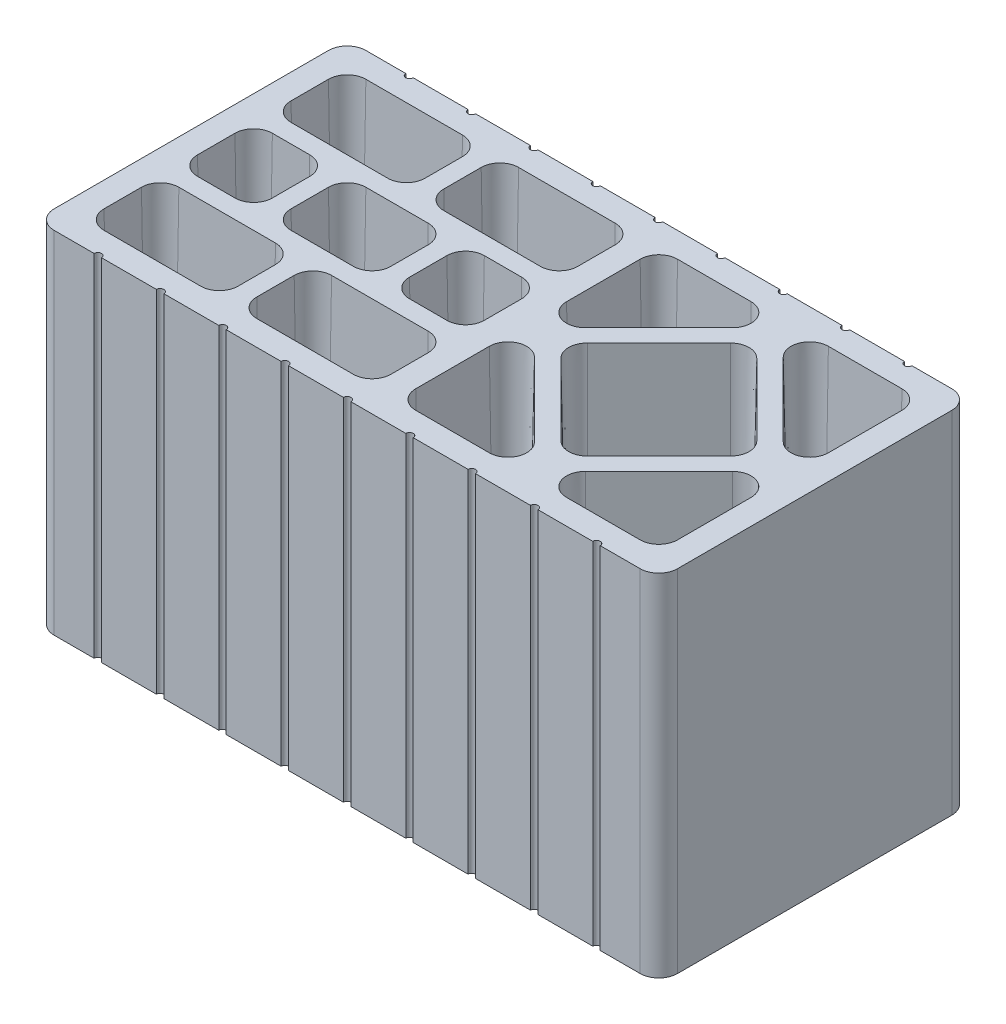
SolidWorks part; units mm, degrees
ref_plane "Plan de face" through (0, 0, 0) normal (0, 0, 1) x (1, 0, 0)
ref_plane "Plan de dessus" through (0, 0, 0) normal (0, 1, 0) x (1, 0, 0)
ref_plane "Plan de droite" through (0, 0, 0) normal (1, 0, 0) x (0, 0, -1)
sketch "Esquisse1" plane through (0, 0, 0) normal (0, 1, 0) x (1, 0, 0)
  line L0 (-4.5271, 0) -> (72.4679, 0) construction
  line L1 (1.5, 0) -> (4.7, 0)
  line L2 (0, 1.5) -> (0, 23.5)
  line L3 (1.5, 25) -> (4.7, 25)
  line L4 (50, 1.5) -> (50, 23.5)
  line L5 (0, -4.2553) -> (0, 43.6965) construction
  line L6 (25, -4.2553) -> (25, 43.6965) construction
  line L7 (-4.5271, 12.5) -> (72.4679, 12.5) construction
  line L8 (12.75, -2.4119) -> (12.75, 14.3543) construction
  line L9 (-4.5271, 2) -> (51.055, 2) construction
  line L10 (2, 28.4811) -> (2, -4.2553) construction
  line L11 (-3.7698, 9.5) -> (25.7079, 9.5) construction
  line L12 (-2.4036, 8.75) -> (-0.3375, 8.75) construction
  line L13 (8, 13.5253) -> (8, 5.2262) construction
  line L14 (3.5, 8) -> (11.25, 8)
  line L15 (2, 6.5) -> (2, 3.5)
  line L16 (13.5, -4.2553) -> (13.5, 14.3543) construction
  line L17 (14.25, -2.4119) -> (14.25, 14.3543) construction
  line L18 (-3.7698, 8) -> (25.7079, 8) construction
  line L19 (3.5, 2) -> (11.25, 2)
  line L20 (12.75, 6.5) -> (12.75, 3.5)
  line L21 (15.75, 8) -> (23.5, 8)
  line L22 (14.25, 6.5) -> (14.25, 3.5)
  line L23 (15.75, 2) -> (23.5, 2)
  line L24 (25, 6.5) -> (25, 3.5)
  line L25 (8.75, 13.5253) -> (8.75, 6.2202) construction
  line L26 (9.5, 13.5253) -> (9.5, 5.2262) construction
  line L27 (2, 14) -> (2, 11)
  line L28 (48, -3.2031) -> (48, 26.4901) construction
  line L29 (40.6005, 2) -> (46.5, 2)
  line L30 (37.5, 28.4811) -> (37.5, -0.4565) construction
  line L31 (37.0995, 2.1204) -> (51.8958, 16.9166) construction
  line L32 (39.5398, 20.4393) -> (45.4393, 14.5398)
  line L33 (36.7665, 3.9086) -> (50.1075, 17.2497) construction
  line L34 (3.5, 9.5) -> (6.5, 9.5)
  line L35 (8, 11) -> (8, 14)
  line L36 (9.5, 14) -> (9.5, 11)
  line L37 (11, 9.5) -> (16, 9.5)
  line L38 (17.5, 14) -> (17.5, 11)
  line L39 (19, 11) -> (19, 14)
  line L40 (23.5, 9.5) -> (20.5, 9.5)
  line L41 (25, 14) -> (25, 11)
  line L42 (48, 15.6005) -> (48, 21.5)
  line L43 (39.5398, 4.5607) -> (45.4393, 10.4602)
  line L44 (40.6005, 23) -> (46.5, 23)
  line L45 (35.4602, 4.5607) -> (29.5607, 10.4602)
  line L46 (23.5, 15.5) -> (20.5, 15.5)
  line L47 (11, 15.5) -> (16, 15.5)
  line L48 (3.5, 15.5) -> (6.5, 15.5)
  line L49 (48, 9.3995) -> (48, 3.5)
  line L50 (25, 18.5) -> (25, 21.5)
  line L51 (15.75, 23) -> (23.5, 23)
  line L52 (14.25, 18.5) -> (14.25, 21.5)
  line L53 (15.75, 17) -> (23.5, 17)
  line L54 (12.75, 18.5) -> (12.75, 21.5)
  line L55 (3.5, 23) -> (11.25, 23)
  line L56 (2, 18.5) -> (2, 21.5)
  line L57 (3.5, 17) -> (11.25, 17)
  line L58 (34.3995, 2) -> (28.5, 2)
  line L59 (27, 9.3995) -> (27, 3.5)
  line L60 (35.4602, 20.4393) -> (29.5607, 14.5398)
  line L61 (27, 15.6005) -> (27, 21.5)
  line L62 (34.3995, 23) -> (28.5, 23)
  line L63 (38.25, 1.0185) -> (38.25, 6.4411) construction
  line L66 (49.2106, 11.75) -> (44.014, 11.75) construction
  line L73 (5.3, 25) -> (9.7, 25)
  line L74 (10.3, 25) -> (14.7, 25)
  line L75 (15.3, 25) -> (19.7, 25)
  line L76 (38.5607, 5.7028) -> (44.2972, 11.4393)
  line L77 (20.3, 25) -> (24.7, 25)
  line L78 (45.3, 25) -> (48.5, 25)
  line L79 (40.3, 25) -> (44.7, 25)
  line L80 (35.3, 25) -> (39.7, 25)
  line L81 (30.3, 25) -> (34.7, 25)
  line L82 (25.3, 25) -> (29.7, 25)
  line L83 (25.3, 0) -> (29.7, 0)
  line L84 (30.3, 0) -> (34.7, 0)
  line L85 (35.3, 0) -> (39.7, 0)
  line L86 (40.3, 0) -> (44.7, 0)
  line L87 (45.3, 0) -> (48.5, 0)
  line L88 (5.3, 0) -> (9.7, 0)
  line L89 (10.3, 0) -> (14.7, 0)
  line L90 (15.3, 0) -> (19.7, 0)
  line L91 (20.3, 0) -> (24.7, 0)
  line L92 (36.4393, 5.7028) -> (30.7028, 11.4393)
  line L121 (36.4393, 19.2972) -> (30.7028, 13.5607)
  line L122 (38.5607, 19.2972) -> (44.2972, 13.5607)
  arc A0 (45.3, 25) -> (44.7, 25) centre (45, 25) cw
  arc A1 (5.3, 0) -> (4.7, 0) centre (5, 0) ccw
  arc A2 (10.3, 0) -> (9.7, 0) centre (10, 0) ccw
  arc A3 (15.3, 0) -> (14.7, 0) centre (15, 0) ccw
  arc A4 (20.3, 0) -> (19.7, 0) centre (20, 0) ccw
  arc A5 (25.3, 0) -> (24.7, 0) centre (25, 0) ccw
  arc A6 (30.3, 0) -> (29.7, 0) centre (30, 0) ccw
  arc A7 (35.3, 0) -> (34.7, 0) centre (35, 0) ccw
  arc A8 (40.3, 0) -> (39.7, 0) centre (40, 0) ccw
  arc A9 (45.3, 0) -> (44.7, 0) centre (45, 0) ccw
  circle A10 centre (0, 0) radius 0.3
  arc A11 (40.3, 25) -> (39.7, 25) centre (40, 25) cw
  arc A12 (35.3, 25) -> (34.7, 25) centre (35, 25) cw
  arc A13 (30.3, 25) -> (29.7, 25) centre (30, 25) cw
  arc A14 (25.3, 25) -> (24.7, 25) centre (25, 25) cw
  arc A15 (20.3, 25) -> (19.7, 25) centre (20, 25) cw
  arc A16 (15.3, 25) -> (14.7, 25) centre (15, 25) cw
  arc A17 (10.3, 25) -> (9.7, 25) centre (10, 25) cw
  arc A18 (5.3, 25) -> (4.7, 25) centre (5, 25) cw
  arc A19 (39.5398, 4.5607) -> (40.6005, 2) centre (40.6005, 3.5) ccw
  arc A20 (48, 9.3995) -> (45.4393, 10.4602) centre (46.5, 9.3995) ccw
  arc A21 (2, 3.5) -> (3.5, 2) centre (3.5, 3.5) ccw
  arc A22 (3.5, 8) -> (2, 6.5) centre (3.5, 6.5) ccw
  arc A23 (2, 11) -> (3.5, 9.5) centre (3.5, 11) ccw
  arc A24 (6.5, 9.5) -> (8, 11) centre (6.5, 11) ccw
  arc A25 (6.5, 15.5) -> (8, 14) centre (6.5, 14) cw
  arc A26 (3.5, 15.5) -> (2, 14) centre (3.5, 14) ccw
  arc A27 (2, 18.5) -> (3.5, 17) centre (3.5, 18.5) ccw
  arc A28 (3.5, 23) -> (2, 21.5) centre (3.5, 21.5) ccw
  arc A29 (11.25, 2) -> (12.75, 3.5) centre (11.25, 3.5) ccw
  arc A30 (11.25, 8) -> (12.75, 6.5) centre (11.25, 6.5) cw
  arc A31 (12.75, 18.5) -> (11.25, 17) centre (11.25, 18.5) cw
  arc A32 (12.75, 21.5) -> (11.25, 23) centre (11.25, 21.5) ccw
  arc A33 (15.75, 23) -> (14.25, 21.5) centre (15.75, 21.5) ccw
  arc A34 (14.25, 18.5) -> (15.75, 17) centre (15.75, 18.5) ccw
  arc A35 (11, 15.5) -> (9.5, 14) centre (11, 14) ccw
  arc A36 (9.5, 11) -> (11, 9.5) centre (11, 11) ccw
  arc A37 (17.5, 11) -> (16, 9.5) centre (16, 11) cw
  arc A38 (16, 15.5) -> (17.5, 14) centre (16, 14) cw
  arc A39 (25, 21.5) -> (23.5, 23) centre (23.5, 21.5) ccw
  arc A40 (25, 18.5) -> (23.5, 17) centre (23.5, 18.5) cw
  arc A41 (20.5, 15.5) -> (19, 14) centre (20.5, 14) ccw
  arc A42 (23.5, 15.5) -> (25, 14) centre (23.5, 14) cw
  arc A43 (23.5, 9.5) -> (25, 11) centre (23.5, 11) ccw
  arc A44 (19, 11) -> (20.5, 9.5) centre (20.5, 11) ccw
  arc A45 (14.25, 3.5) -> (15.75, 2) centre (15.75, 3.5) ccw
  arc A46 (15.75, 8) -> (14.25, 6.5) centre (15.75, 6.5) ccw
  arc A47 (23.5, 2) -> (25, 3.5) centre (23.5, 3.5) ccw
  arc A48 (23.5, 8) -> (25, 6.5) centre (23.5, 6.5) cw
  arc A49 (44.2972, 11.4393) -> (44.2972, 13.5607) centre (43.2365, 12.5) ccw
  arc A50 (36.4393, 19.2972) -> (38.5607, 19.2972) centre (37.5, 18.2365) cw
  arc A51 (30.7028, 11.4393) -> (30.7028, 13.5607) centre (31.7635, 12.5) cw
  arc A52 (38.5607, 5.7028) -> (36.4393, 5.7028) centre (37.5, 6.7635) cw
  arc A53 (48, 3.5) -> (46.5, 2) centre (46.5, 3.5) cw
  arc A54 (48, 15.6005) -> (45.4393, 14.5398) centre (46.5, 15.6005) cw
  arc A55 (48, 21.5) -> (46.5, 23) centre (46.5, 21.5) ccw
  arc A56 (39.5398, 20.4393) -> (40.6005, 23) centre (40.6005, 21.5) cw
  arc A57 (35.4602, 4.5607) -> (34.3995, 2) centre (34.3995, 3.5) cw
  arc A58 (27, 3.5) -> (28.5, 2) centre (28.5, 3.5) ccw
  arc A59 (27, 9.3995) -> (29.5607, 10.4602) centre (28.5, 9.3995) cw
  arc A60 (27, 15.6005) -> (29.5607, 14.5398) centre (28.5, 15.6005) ccw
  arc A61 (27, 21.5) -> (28.5, 23) centre (28.5, 21.5) cw
  arc A62 (35.4602, 20.4393) -> (34.3995, 23) centre (34.3995, 21.5) ccw
  arc A63 (0, 23.5) -> (1.5, 25) centre (1.5, 23.5) cw
  arc A64 (1.5, 0) -> (0, 1.5) centre (1.5, 1.5) cw
  arc A65 (48.5, 0) -> (50, 1.5) centre (48.5, 1.5) ccw
  arc A66 (48.5, 25) -> (50, 23.5) centre (48.5, 23.5) cw
  point P72 (2, 2)
  point P76 (2, 8)
  point P79 (2, 9.5)
  point P82 (8, 9.5)
  point P125 (8, 15.5)
  point P156 (2, 15.5)
  point P162 (2, 17)
  point P165 (2, 23)
  point P168 (12.75, 2)
  point P171 (12.75, 8)
  point P174 (12.75, 17)
  point P177 (12.75, 23)
  point P180 (14.25, 23)
  point P183 (14.25, 17)
  point P186 (9.5, 15.5)
  point P189 (9.5, 9.5)
  point P192 (17.5, 9.5)
  point P195 (17.5, 15.5)
  point P198 (25, 23)
  point P201 (25, 17)
  point P204 (19, 15.5)
  point P207 (25, 15.5)
  point P210 (25, 9.5)
  point P213 (19, 9.5)
  point P216 (14.25, 2)
  point P219 (14.25, 8)
  point P222 (25, 2)
  point P225 (25, 8)
  point P228 (45.3579, 12.5)
  point P231 (37.5, 20.3579)
  point P234 (29.6421, 12.5)
  point P237 (37.5, 4.6421)
  point P240 (48, 2)
  point P270 (0, 25)
  point P273 (0, 0)
  point P276 (50, 0)
  dimension "D14" = 10
  dimension "D15" = 1.5
  dimension "D16" = 1.5
  dimension "D1" = 25
  dimension "D2" = 12.5
  dimension "D3" = 2
  dimension "D4" = 2
  dimension "D5" = 6
  dimension "D6" = 1.5
  dimension "D7" = 0.75
  dimension "D8" = 11.5
  dimension "D9" = 0.75
  dimension "D10" = 0.75
  dimension "D11" = 1.5
  dimension "D12" = 0.75
  dimension "D13" = 6
  dimension "D18" = 2
  dimension "D20" = 1.5
  dimension "D27" = 0.75
  dimension "D28" = 0.75
extrude "Boss.-Extru.1" add sketch "Esquisse1" along normal blind 28.125
draft "Dépouille1" type of draft neutral plane draft angle 1 faces to draft 88 parameters "D1"=1
